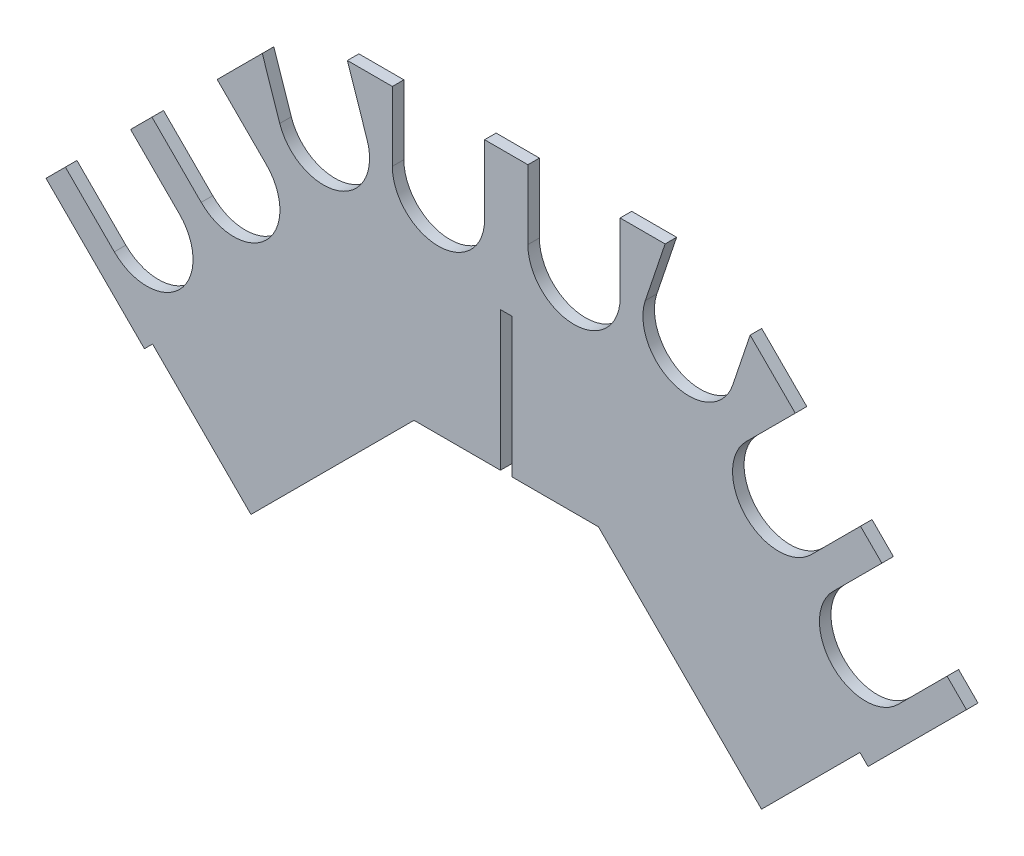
SolidWorks part; units mm, degrees
ref_plane "Front Plane" through (0, 0, 0) normal (0, 0, 1) x (1, 0, 0)
ref_plane "Top Plane" through (0, 0, 0) normal (0, 1, 0) x (1, 0, 0)
ref_plane "Right Plane" through (0, 0, 0) normal (1, 0, 0) x (0, 0, -1)
sketch "Sketch1" plane through (0, 0, 0) normal (0, 0, 1) x (1, 0, 0)
  line L0 (506.9879, 506.9879) -> (228.6, 785.3759) construction
  line L1 (-506.9879, 506.9879) -> (-228.6, 785.3759) construction
  line L2 (-228.6, 785.3759) -> (228.6, 785.3759) construction
  line L3 (506.9879, 506.9879) -> (228.6, 785.3759)
  line L4 (-506.9879, 506.9879) -> (-228.6, 785.3759)
  line L5 (-228.6, 785.3759) -> (228.6, 785.3759)
  line L6 (165.1, 632.0733) -> (398.5867, 398.5867) construction
  line L8 (-165.1, 632.0733) -> (-398.5867, 398.5867) construction
  line L9 (389.6064, 407.5669) -> (398.5867, 398.5867)
  line L10 (-6.35, 785.3759) -> (-6.35, 101.6) construction
  line L11 (-389.6064, 407.5669) -> (-398.5867, 398.5867)
  line L12 (398.5867, 398.5867) -> (506.9879, 506.9879) construction
  line L13 (-398.5867, 398.5867) -> (-506.9879, 506.9879) construction
  line L14 (398.5867, 398.5867) -> (506.9879, 506.9879)
  line L15 (-398.5867, 398.5867) -> (-506.9879, 506.9879)
  line L17 (-498.0077, 515.9682) -> (-14.5051, 32.4656) construction
  line L18 (498.0077, 515.9682) -> (14.5051, 32.4656) construction
  line L20 (6.35, 785.3759) -> (6.35, 101.6) construction
  line L21 (-389.6064, 407.5669) -> (-281.2051, 299.1656)
  line L22 (389.6064, 407.5669) -> (281.2051, 299.1656)
  line L23 (-6.35, 632.0733) -> (-6.35, 478.7708)
  line L24 (-101.6, 478.7708) -> (-290.1854, 290.1854) construction
  line L25 (-101.6, 478.7708) -> (101.6, 478.7708) construction
  line L26 (101.6, 478.7708) -> (290.1854, 290.1854) construction
  line L27 (-101.6, 478.7708) -> (-281.2051, 299.1656)
  line L28 (-101.6, 478.7708) -> (-6.35, 478.7708)
  line L29 (101.6, 478.7708) -> (281.2051, 299.1656)
  line L30 (6.35, 632.0733) -> (6.35, 478.7708)
  line L31 (-6.35, 632.0733) -> (6.35, 632.0733) construction
  line L32 (-6.35, 632.0733) -> (6.35, 632.0733)
  line L33 (6.35, 478.7708) -> (101.6, 478.7708)
  circle A0 centre (395.8242, 510.3886) radius 50.8 construction
  circle A1 centre (300.1229, 605.4517) radius 50.8 construction
  circle A2 centre (-395.8242, 510.3886) radius 50.8 construction
  circle A3 centre (-300.1229, 605.4517) radius 50.8 construction
  circle A4 centre (-201.3401, 704.2345) radius 50.8 construction
  circle A5 centre (-74.6592, 709.1759) radius 50.8 construction
  circle A6 centre (74.6592, 709.1759) radius 50.8 construction
  circle A7 centre (201.3401, 704.2345) radius 50.8 construction
  circle A8 centre (395.8242, 510.3886) radius 50.8
  circle A9 centre (300.1229, 605.4517) radius 50.8
  circle A10 centre (-395.8242, 510.3886) radius 50.8
  circle A11 centre (-300.1229, 605.4517) radius 50.8
  circle A12 centre (-201.3401, 704.2345) radius 50.8
  circle A13 centre (-74.6592, 709.1759) radius 50.8
  circle A14 centre (74.6592, 709.1759) radius 50.8
  circle A15 centre (201.3401, 704.2345) radius 50.8
extrude "Extrude1" add sketch "Sketch1" along normal blind 12.7
sketch "Sketch2" plane through (0, 0, 12.7) normal (0, 0, 1) x (1, 0, 0)
  line L0 (249.4952, 688.0565) -> (268.7137, 745.2621)
  line L1 (175.0098, 785.3759) -> (153.185, 720.4124)
  line L2 (125.4592, 785.3759) -> (125.4592, 709.1759)
  line L3 (23.8592, 785.3759) -> (23.8592, 709.1759)
  line L4 (201.3401, 704.2345) -> (228.6, 785.3759) construction
  line L5 (-23.8592, 785.3759) -> (-23.8592, 709.1759)
  line L6 (-125.4592, 785.3759) -> (-125.4592, 709.1759)
  line L7 (-268.7137, 745.2621) -> (-249.4952, 688.0565)
  line L8 (-175.0098, 785.3759) -> (-153.185, 720.4124)
  line L9 (-318.4026, 695.5733) -> (-264.2019, 641.3727)
  line L10 (-390.2446, 623.7313) -> (-336.044, 569.5306)
  line L11 (-413.7847, 600.1911) -> (-359.9032, 546.3096)
  line L12 (-485.6268, 528.3491) -> (-431.7453, 474.4676)
  line L13 (318.4026, 695.5733) -> (264.2019, 641.3727)
  line L14 (413.7847, 600.1911) -> (359.9032, 546.3096)
  line L15 (390.2446, 623.7313) -> (336.044, 569.5306)
  line L16 (485.6268, 528.3491) -> (431.7453, 474.4676)
  line L17 (-228.6, 785.3759) -> (-506.9879, 506.9879) construction
  line L18 (506.9879, 506.9879) -> (228.6, 785.3759) construction
  line L19 (228.6, 785.3759) -> (-228.6, 785.3759) construction
  line L20 (-228.6, 785.3759) -> (-268.7137, 745.2621)
  line L21 (485.6268, 528.3491) -> (413.7847, 600.1911)
  line L22 (228.6, 785.3759) -> (175.0098, 785.3759)
  line L23 (-175.0098, 785.3759) -> (-228.6, 785.3759)
  line L24 (-23.8592, 785.3759) -> (-125.4592, 785.3759)
  line L25 (125.4592, 785.3759) -> (23.8592, 785.3759)
  line L26 (-201.3401, 704.2345) -> (-228.6, 785.3759) construction
  line L27 (-413.7847, 600.1911) -> (-485.6268, 528.3491)
  line L28 (-318.4026, 695.5733) -> (-390.2446, 623.7313)
  line L29 (268.7137, 745.2621) -> (228.6, 785.3759)
  line L30 (390.2446, 623.7313) -> (318.4026, 695.5733)
  circle A0 centre (-395.8242, 510.3886) radius 50.8 construction
  circle A1 centre (-300.1229, 605.4517) radius 50.8 construction
  circle A2 centre (-201.3401, 704.2345) radius 50.8 construction
  circle A3 centre (-74.6592, 709.1759) radius 50.8 construction
  circle A4 centre (74.6592, 709.1759) radius 50.8 construction
  circle A5 centre (201.3401, 704.2345) radius 50.8 construction
  circle A6 centre (395.8242, 510.3886) radius 50.8 construction
  circle A7 centre (300.1229, 605.4517) radius 50.8 construction
  arc A8 (-359.9032, 546.3096) -> (-431.7453, 474.4676) centre (-395.8242, 510.3886) ccw
  arc A9 (-264.2019, 641.3727) -> (-336.044, 569.5306) centre (-300.1229, 605.4517) ccw
  arc A10 (-153.185, 720.4124) -> (-249.4952, 688.0565) centre (-201.3401, 704.2345) ccw
  arc A11 (-23.8592, 709.1759) -> (-125.4592, 709.1759) centre (-74.6592, 709.1759) ccw
  arc A12 (125.4592, 709.1759) -> (23.8592, 709.1759) centre (74.6592, 709.1759) ccw
  arc A13 (249.4952, 688.0565) -> (153.185, 720.4124) centre (201.3401, 704.2345) ccw
  arc A14 (336.044, 569.5306) -> (264.2019, 641.3727) centre (300.1229, 605.4517) ccw
  arc A15 (431.7453, 474.4676) -> (359.9032, 546.3096) centre (395.8242, 510.3886) ccw
extrude "Cut-Extrude1" cut sketch "Sketch2" against normal up to next
